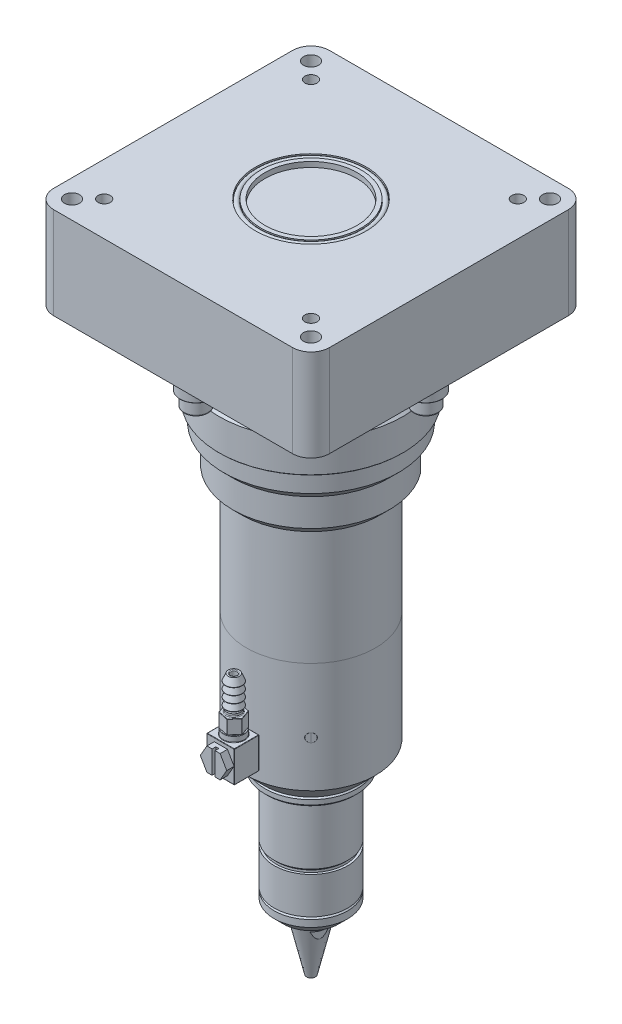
SolidWorks part; units mm, degrees
ref_plane "Front Plane" through (0, 0, 0) normal (0, 0, 1) x (1, 0, 0)
ref_plane "Top Plane" through (0, 0, 0) normal (0, 1, 0) x (1, 0, 0)
ref_plane "Right Plane" through (0, 0, 0) normal (1, 0, 0) x (0, 0, -1)
imported_body "Defeatured1"
hole_wizard "CBORE for M5 SHCS1" positions "Sketch1" profile "Sketch2" counterbore size "M5" standard "HAAS"
sketch "Sketch1" plane through (0, 0, 0) normal (0, -1, 0) x (-1, 0, 0)
  line L0 (0, 0) -> (0, -58.7909) construction
  line L2 (0, 0) -> (-53.9039, 0) construction
  point P0 (41.275, 41.275)
  point P13 (41.275, -41.275)
  point P14 (-41.275, -41.275)
  point P15 (-41.275, 41.275)
  dimension "D1" = 41.275
  dimension "D2" = 41.275
sketch "Sketch2" plane through (-41.275, 0, -41.275) normal (1, 0, 0) x (0, 0, -1)
  line L0 (0, 0) -> (0, 31.75)
  line L1 (0, 31.75) -> (2.6035, 31.75)
  line L3 (2.6035, 31.75) -> (2.6035, 5.334)
  line L4 (2.6035, 5.334) -> (4.3561, 5.334)
  line L5 (4.3561, 5.334) -> (4.3561, 0)
  line L7 (4.3561, 0) -> (0, 0)
  line L11 (0, -6.35) -> (0, 107.95) construction
  dimension "Thru Hole Dia." = 5.207
  dimension "Thru Hole Depth" = 31.75
  dimension "C'Bore Dia." = 8.7122
  dimension "C'Bore Depth" = 5.334
